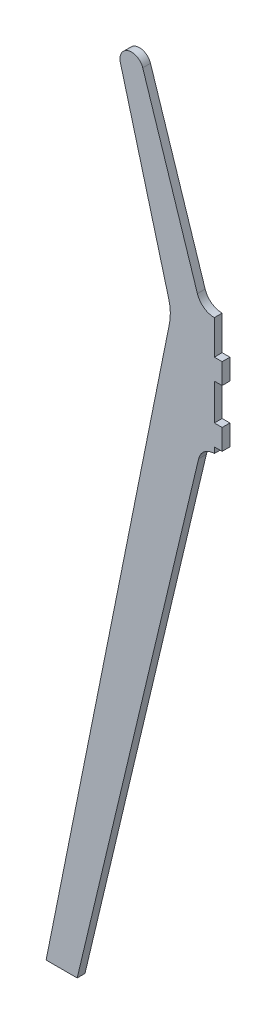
SolidWorks part; units mm, degrees
ref_plane "Alzado" through (0, 0, 0) normal (0, 0, 1) x (1, 0, 0)
ref_plane "Planta" through (0, 0, 0) normal (0, 1, 0) x (1, 0, 0)
ref_plane "Vista lateral" through (0, 0, 0) normal (1, 0, 0) x (0, 0, -1)
sketch "Croquis1" plane through (0, 0, 0) normal (0, 0, 1) x (1, 0, 0)
  line L0 (-332.1792, -1195.8451) -> (-272.1792, -1195.8451)
  line L7 (-332.1792, -1195.8451) -> (-332.1792, 604.1549) construction
  line L8 (-332.1792, 604.1549) -> (167.8208, 604.1549) construction
  line L9 (167.8208, -305.2261) -> (167.8208, 604.1549) construction
  line L10 (-332.1792, -1195.8451) -> (167.8208, 604.1549) construction
  line L11 (-332.1792, 604.1549) -> (167.8208, -305.2261) construction
  line L12 (-272.1792, -1195.8451) -> (-37.91, -210.9948)
  line L13 (0, 0) -> (0, -50000) construction
  line L14 (-7.5, 604.1549) -> (-7.5, -900) construction
  line L15 (-7.5, -186.9701) -> (-7.5, -175.9001)
  line L16 (-7.5, -175.9001) -> (7.5, -175.9001)
  line L17 (7.5, -175.9001) -> (7.5, -135.9001)
  line L18 (7.5, -135.9001) -> (-7.5, -135.9001)
  line L19 (-332.1792, -1195.8451) -> (-94.2175, -13.6041)
  line L20 (-95.5147, 27.4486) -> (-188.861, 375.8218)
  line L21 (-145.7141, 388.6025) -> (-40.2274, 63.9478)
  line L22 (-7.5, -135.9001) -> (-7.5, -65.9001)
  line L23 (-7.5, -80.9001) -> (7.5, -80.9001) construction
  line L24 (-7.5, -80.9001) -> (-7.5, -120.9001) construction
  line L25 (-7.5, -120.9001) -> (7.5, -120.9001) construction
  line L26 (7.5, -80.9001) -> (7.5, -120.9001) construction
  line L27 (-7.5, -65.9001) -> (7.5, -65.9001)
  line L28 (7.5, -65.9001) -> (7.5, -25.9001)
  line L29 (7.5, -25.9001) -> (-7.5, -25.9001)
  line L30 (-7.5, -25.9001) -> (-7.5, 40.1699)
  line L31 (-167.1202, 404.1549) -> (-332.1792, 404.1549) construction
  line L32 (-7.5, -1195.8451) -> (7.5, -1195.8451) construction
  line L33 (-7.5, -10.9001) -> (7.5, -10.9001) construction
  line L34 (-7.5, -10.9001) -> (-7.5, 29.0999) construction
  line L35 (-7.5, 29.0999) -> (7.5, 29.0999) construction
  line L36 (7.5, -10.9001) -> (7.5, 29.0999) construction
  line L37 (7.5, -186.9701) -> (-7.5, -186.9701) construction
  arc A0 (-37.91, -210.9948) -> (-7.5, -186.9701) centre (-7.5, -218.2286) cw
  arc A1 (-94.2175, -13.6041) -> (-95.5147, 27.4486) centre (-182.448, 4.1549) ccw
  arc A2 (-188.861, 375.8218) -> (-145.7141, 388.6025) centre (-167.1202, 381.6472) cw
  arc A3 (-40.2274, 63.9478) -> (-7.5, 40.1699) centre (-7.5, 74.5815) ccw
  point P0 (0, 0)
  point P25 (0, 0)
  point P41 (0, 0)
  point P43 (-14.2107, 95.7671)
extrude "Saliente-Extruir1" add sketch "Croquis1" along normal mid plane 15
equation "\"Thickness\"=15"
equation "\"D3@Croquis1\"=\"Thickness\"/2"
equation "\"D6@Croquis1\"=\"Thickness\""
equation "\"D1@Saliente-Extruir1\"=\"Thickness\""
